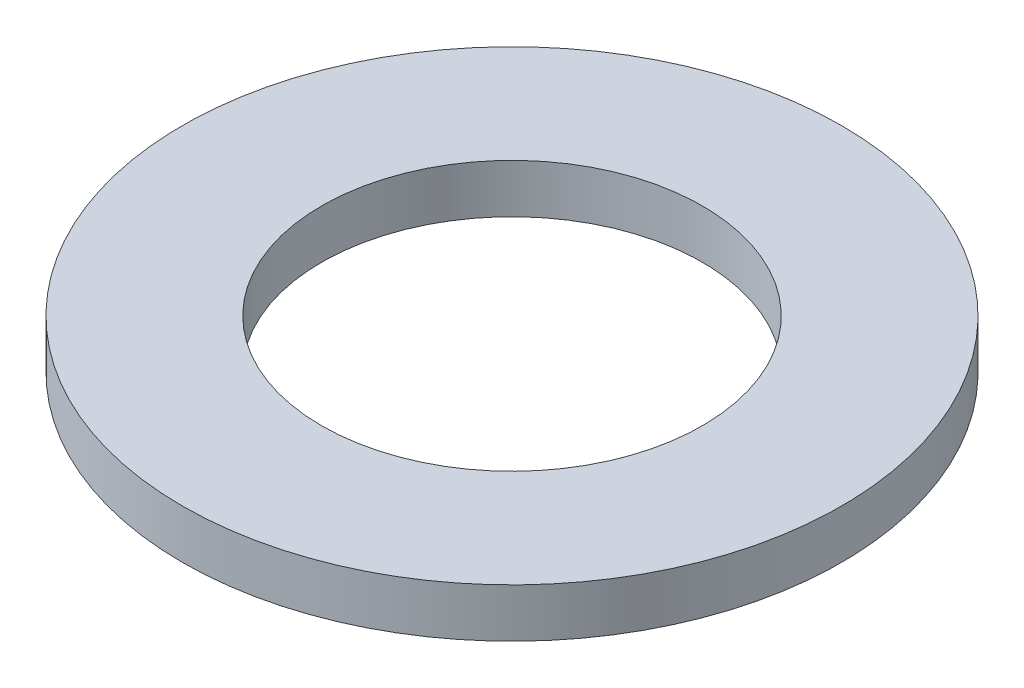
SolidWorks part; units mm, degrees
ref_plane "Front" through (0, 0, 0) normal (0, 0, 1) x (1, 0, 0)
ref_plane "Top" through (0, 0, 0) normal (0, 1, 0) x (1, 0, 0)
ref_plane "Right" through (0, 0, 0) normal (1, 0, 0) x (0, 0, -1)
sketch "Sketch1" plane through (0, 0, 0) normal (0, 1, 0) x (1, 0, 0)
  circle A0 centre (0, 0) radius 39
  circle A1 centre (0, 0) radius 67.5
extrude "Extrude1" add sketch "Sketch1" along normal blind 10
